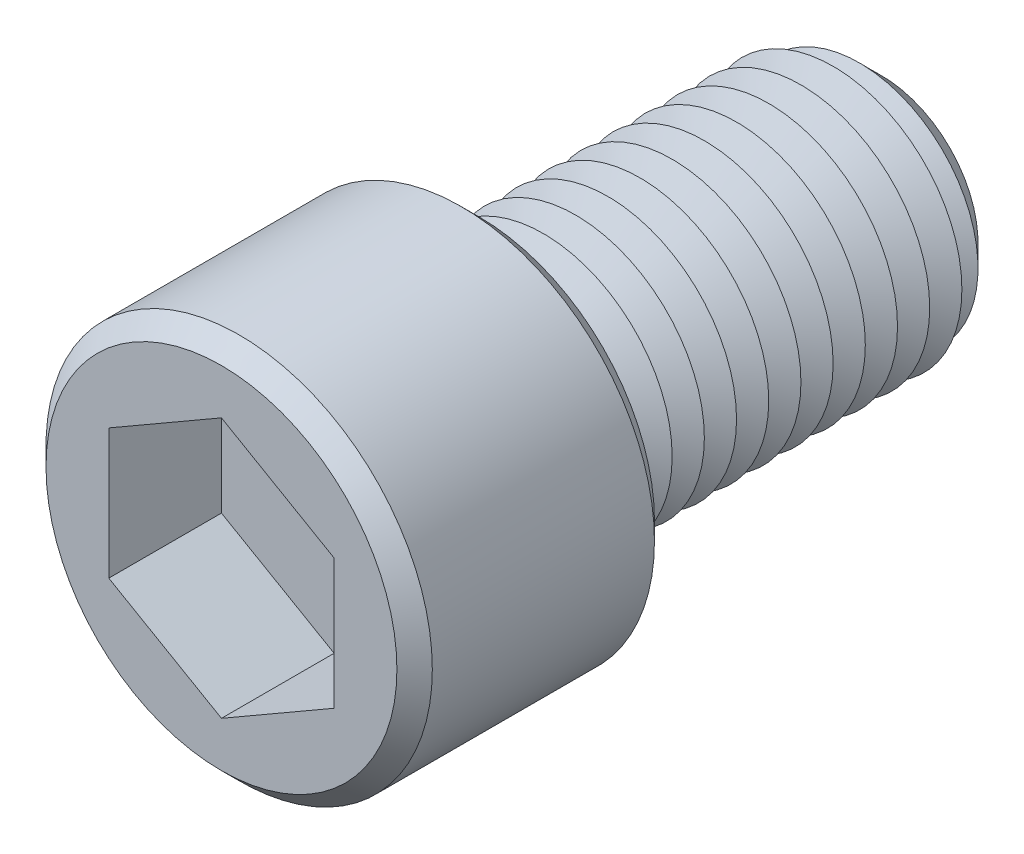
SolidWorks part; units mm, degrees
ref_plane "Front Plane" through (0, 0, 0) normal (0, 0, 1) x (1, 0, 0)
ref_plane "Top Plane" through (0, 0, 0) normal (0, 1, 0) x (1, 0, 0)
ref_plane "Right Plane" through (0, 0, 0) normal (1, 0, 0) x (0, 0, -1)
sketch "Sketch1" plane through (0, 0, 0) normal (0, 0, 1) x (1, 0, 0)
  circle A0 centre (0, 0) radius 12
  dimension "D1" = 24
extrude "Boss-Extrude1" add sketch "Sketch1" along normal blind 16
sketch "Sketch2" plane through (0, 0, 0) normal (0, 0, -1) x (-1, 0, 0)
  circle A0 centre (0, 0) radius 8
  dimension "D1" = 16
extrude "Boss-Extrude2" add sketch "Sketch2" along normal blind 25
chamfer "Chamfer1" distance 2 angle 45 1 edges at (-8, 0, -25)
sketch "Sketch3" plane through (0, 0, 0) normal (1, 0, 0) x (0, 0, -1)
  line L0 (-2.5121, 0) -> (4.5776, 0) construction
sketch "Sketch4" plane through (0, 0, 0) normal (1, 0, 0) x (0, 0, -1)
  line L0 (0, 8) -> (1, 6.2679)
  line L1 (1, 6.2679) -> (2, 8)
  line L2 (23, 8) -> (0, 8) construction
  line L3 (2, 8) -> (0, 8)
  dimension "D1" = 2
revolve "Cut-Revolve1" cut sketch "Sketch4" angle 360 about L0
pattern_linear "LPattern1" count 12 spacing 2 along (0, 0, -1) of "Cut-Revolve1"
sketch "Sketch5" plane through (0, 0, 16) normal (0, 0, 1) x (1, 0, 0)
  line L1 (0, 8.0829) -> (-7, 4.0415)
  line L2 (-7, 4.0415) -> (-7, -4.0415)
  line L3 (-7, -4.0415) -> (0, -8.0829)
  line L4 (0, -8.0829) -> (7, -4.0415)
  line L5 (7, -4.0415) -> (7, 4.0415)
  line L6 (7, 4.0415) -> (0, 8.0829)
  circle A0 centre (0, 0) radius 7 construction
  dimension "D1" = 14
extrude "Cut-Extrude1" cut sketch "Sketch5" against normal blind 7
sketch "Sketch6" plane through (0, 0, 9) normal (0, 0, 1) x (1, 0, 0)
  circle A0 centre (0, 0) radius 0.9
  dimension "D1" = 1.8
extrude "Cut-Extrude2" cut sketch "Sketch6" against normal up to surface (34 mm away)
chamfer "Chamfer2" distance 1.1 angle 45 2 edges at (12, 0, 0) (12, 0, 16)
